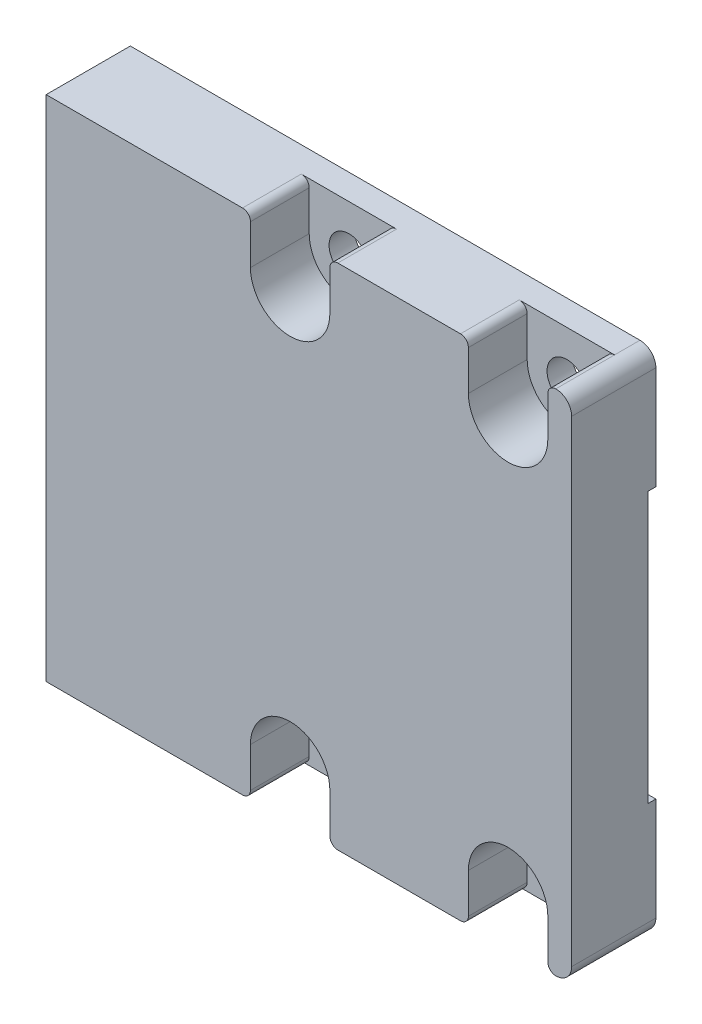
SolidWorks part; units mm, degrees
ref_plane "Front Plane" through (0, 0, 0) normal (0, 0, 1) x (1, 0, 0)
ref_plane "Top Plane" through (0, 0, 0) normal (0, 1, 0) x (1, 0, 0)
ref_plane "Right Plane" through (0, 0, 0) normal (1, 0, 0) x (0, 0, -1)
sketch "Sketch1" plane through (0, 0, 0) normal (0, 0, 1) x (1, 0, 0)
  line L3 (41.2013, 1.8041) -> (41.2013, 9.2941) construction
  line L4 (41.2013, 33.8041) -> (41.2013, 1.8041)
  line L5 (8.1213, 33.8041) -> (41.2013, 33.8041)
  line L6 (41.2013, 1.8041) -> (8.1213, 1.8041)
  line L7 (8.1213, 1.8041) -> (8.1213, 33.8041)
  line L8 (8.1213, 1.8041) -> (8.1213, 9.2093) construction
  line L10 (8.1213, 1.8041) -> (40.2013, 1.8041) construction
  line L11 (40.2013, 33.8041) -> (8.1213, 33.8041) construction
  circle A1 centre (23.4813, 4.8041) radius 1.25
  circle A2 centre (37.2013, 30.8041) radius 1.25
  circle A3 centre (37.2013, 4.8041) radius 1.25
  circle A4 centre (23.4813, 30.8041) radius 1.25
  dimension "D1" = 2.5
extrude "Boss-Extrude1" add sketch "Sketch1" along normal offset from surface (5.3 mm away) 0.2 contours L7 L6 L4 L5 A4 A3 A2 A1
fillet "Fillet1" radius 1 2 edges at (41.2013, 33.8041, 2.65) (41.2013, 1.8041, 2.65)
sketch "Sketch2" plane through (0, 0, 0) normal (0, 0, -1) x (-1, 0, 0)
  line L1 (-41.2013, 9.2941) -> (-31.2013, 9.2941)
  line L2 (-41.2013, 9.2941) -> (-41.2013, 26.3141)
  line L3 (-41.2013, 26.3141) -> (-31.2013, 26.3141)
  line L4 (-31.2013, 9.2941) -> (-31.2013, 26.3141)
  line L5 (-31.2013, 17.8041) -> (-8.1213, 17.8041) construction
  line L6 (-8.1213, 1.8041) -> (-8.1213, 33.8041) construction
  line L9 (-41.2013, 32.8041) -> (-41.2013, 2.8041) construction
  dimension "D1" = 17.02
  dimension "D3" = 10
extrude "Cut-Extrude2" cut sketch "Sketch2" against normal blind 0.5
sketch "Sketch4" plane through (0, 0, 5.3) normal (0, 0, 1) x (1, 0, 0)
  line L0 (20.9813, 4.8041) -> (20.9813, 1.8041)
  line L1 (8.1213, 1.8041) -> (40.2013, 1.8041) construction
  line L2 (20.9813, 1.8041) -> (25.9813, 1.8041)
  line L3 (25.9813, 1.8041) -> (25.9813, 4.8041)
  line L5 (34.7013, 4.8041) -> (34.7013, 1.8041)
  line L6 (34.7013, 1.8041) -> (39.7013, 1.8041)
  line L7 (39.7013, 1.8041) -> (39.7013, 4.8041)
  line L9 (39.7013, 30.8041) -> (39.7013, 33.8041)
  line L10 (40.2013, 33.8041) -> (8.1213, 33.8041) construction
  line L11 (39.7013, 33.8041) -> (34.7013, 33.8041)
  line L12 (34.7013, 33.8041) -> (34.7013, 30.8041)
  line L14 (25.9813, 30.8041) -> (25.9813, 33.8041)
  line L15 (25.9813, 33.8041) -> (20.9813, 33.8041)
  line L16 (20.9813, 33.8041) -> (20.9813, 30.8041)
  circle A0 centre (23.4813, 4.8041) radius 2.5 construction
  circle A1 centre (37.2013, 4.8041) radius 2.5 construction
  circle A2 centre (37.2013, 30.8041) radius 2.5 construction
  circle A3 centre (23.4813, 30.8041) radius 2.5 construction
  arc A4 (25.9813, 4.8041) -> (20.9813, 4.8041) centre (23.4813, 4.8041) ccw
  arc A5 (20.9813, 30.8041) -> (25.9813, 30.8041) centre (23.4813, 30.8041) ccw
  arc A6 (34.7013, 4.8041) -> (39.7013, 4.8041) centre (37.2013, 4.8041) cw
  arc A7 (34.7013, 30.8041) -> (39.7013, 30.8041) centre (37.2013, 30.8041) ccw
  point P0 (23.4813, 4.8041)
  point P3 (37.2013, 4.8041)
  point P6 (37.2013, 30.8041)
  point P9 (23.4813, 30.8041)
  dimension "D1" = 5
extrude "Cut-Extrude1" cut sketch "Sketch4" against normal offset from surface (3.7 mm away) 1.6
fillet "Fillet2" radius 0.5 8 edges at (34.7013, 33.8041, 3.45) (39.7013, 33.8041, 3.45) (39.7013, 1.8041, 3.45) (25.9813, 1.8041, 3.45) (20.9813, 1.8041, 3.45) (20.9813, 33.8041, 3.45) (25.9813, 33.8041, 3.45) (34.7013, 1.8041, 3.45)
chamfer "Chamfer1" distance 0.5 angle 45 1 edges at (31.2013, 17.8041, 0)
